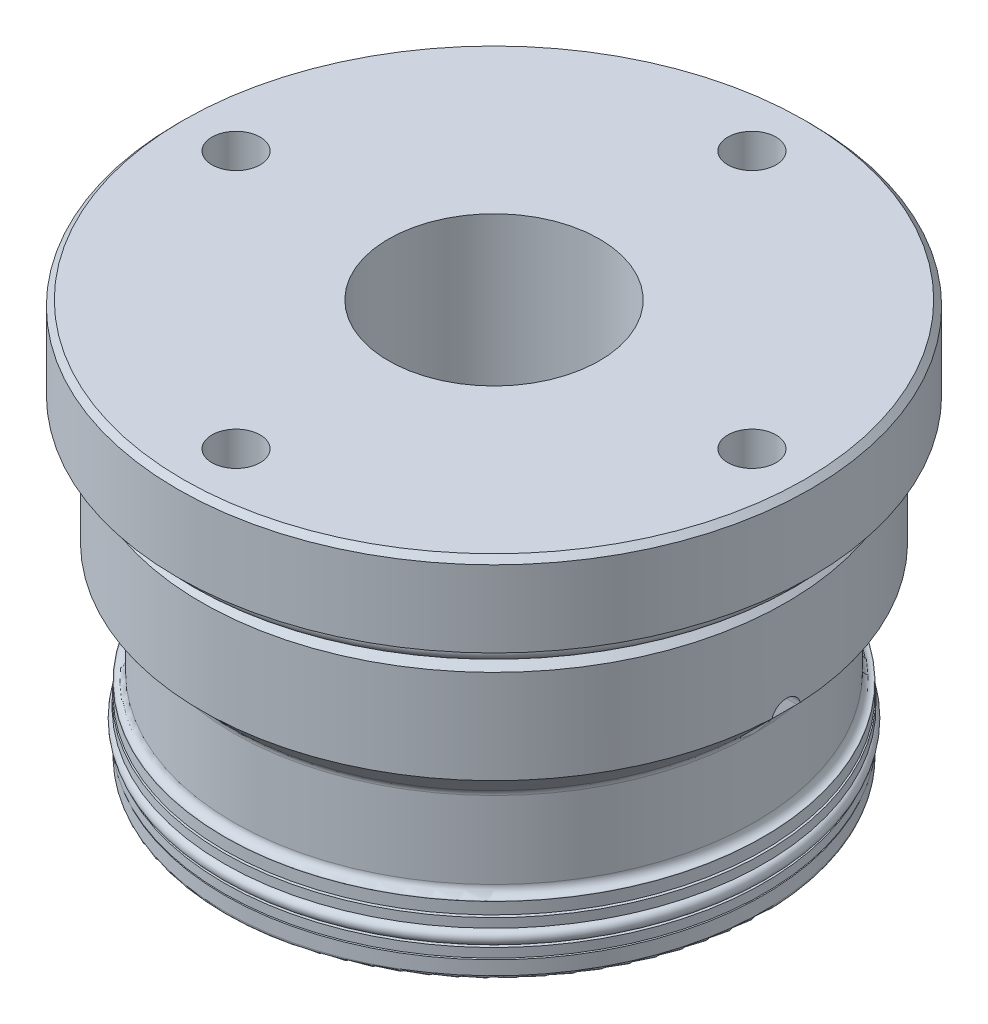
SolidWorks part; units mm, degrees
ref_plane "Front Plane" through (0, 0, 0) normal (0, 0, 1) x (1, 0, 0)
ref_plane "Top Plane" through (0, 0, 0) normal (0, 1, 0) x (1, 0, 0)
ref_plane "Right Plane" through (0, 0, 0) normal (1, 0, 0) x (0, 0, -1)
sketch "Sketch1" plane through (0, 0, 0) normal (0, 0, 1) x (1, 0, 0)
  line L0 (0, 0) -> (0, 29.1031) construction
  line L1 (-30.1625, 0) -> (-30.1625, 27.432)
  line L2 (-30.1625, 27.432) -> (-14.2875, 27.432)
  line L3 (-14.2875, 27.432) -> (-14.2875, 53.975)
  line L4 (-14.2875, 53.975) -> (-42.8625, 53.975)
  line L5 (-42.8625, 53.975) -> (-42.8625, 42.8752)
  line L6 (-42.8625, 42.8752) -> (-39.5986, 42.8752)
  line L7 (-39.5986, 42.8752) -> (-39.5986, 25.5905)
  line L8 (-39.5986, 25.5905) -> (-35.2806, 21.2725)
  line L9 (-35.2806, 21.2725) -> (-35.2806, 9.2202)
  line L10 (-35.2806, 9.2202) -> (-36.4744, 9.2202)
  line L11 (-36.4744, 9.2202) -> (-36.4744, 7.6454)
  line L12 (-36.4744, 7.6454) -> (-35.2171, 7.6454)
  line L13 (-35.2171, 7.6454) -> (-35.2171, 2.3876)
  line L14 (-35.2171, 2.3876) -> (-36.4744, 2.3876)
  line L15 (-36.4744, 2.3876) -> (-36.4744, 0)
  line L16 (-36.4744, 0) -> (-30.1625, 0)
  dimension "D1" = 27.432
  dimension "D2" = 53.975
  dimension "D3" = 85.725
  dimension "D4" = 28.575
  dimension "D5" = 60.325
  dimension "D6" = 72.9488
  dimension "D7" = 2.3876
  dimension "D8" = 1.5748
  dimension "D9" = 70.4342
  dimension "D10" = 5.2578
  dimension "D11" = 42.8752
  dimension "D12" = 79.1972
  dimension "D13" = 70.5612
  dimension "D14" = 25.5905
  dimension "D15" = 45
revolve "Revolve1" add sketch "Sketch1" angle 360 about L0
fillet "Fillet1" radius 1.143 2 edges at (0, 21.2725, -35.2806) (0, 9.2202, -35.2806)
fillet "Fillet2" radius 0.381 2 edges at (0, 7.6454, -35.2171) (0, 2.3876, -35.2171)
fillet "Fillet3" radius 0.508 1 edges at (0, 0, -36.4744)
hole_wizard "Hole1" positions "Sketch3" profile "Sketch2" legacy
sketch "Sketch3" plane through (0, 53.975, 0) normal (0, 1, 0) x (-1, 0, 0)
  circle A0 centre (0, 0) radius 34.925 construction
  point P0 (-34.925, 0)
  dimension "D1" = 34.925
sketch "Sketch2" plane through (34.925, 53.975, 0) normal (1, 0, 0) x (0, 0, 1)
  line L0 (0, 0) -> (0, 8.3111)
  line L1 (0, 8.3111) -> (3.2639, 6.35)
  line L2 (3.2639, 6.35) -> (3.2639, 0)
  line L4 (3.2639, 0) -> (0, 0)
  line L6 (0, 8.3111) -> (-3.2639, 6.35) construction
  line L7 (0, -4.2442) -> (0, 117.3081) construction
  dimension "Diameter" = 6.5278
  dimension "Depth" = 6.35
  dimension "Drill Angle" = 118
pattern_circular "CirPattern1" count 4 over 360 about axis through (0, 0, 0) along (0, 1, 0) of "Hole1"
chamfer "Chamfer1" distance 0.762 angle 45 1 edges at (0, 53.975, -42.8625)
sketch "Sketch4" plane through (0, 0, 0) normal (0, 0, 1) x (1, 0, 0)
  line L0 (0, 0) -> (0, 41.4124) construction
  line L1 (-39.5986, 42.8752) -> (-39.5986, 38.2905)
  line L2 (-39.5986, 42.8752) -> (-39.5986, 25.5905) construction
  line L3 (-39.5986, 38.2905) -> (-38.4683, 39.4208)
  line L4 (-38.4683, 39.4208) -> (-38.4683, 42.8752)
  line L5 (-39.5986, 42.8752) -> (39.5986, 42.8752) construction
  line L6 (-38.4683, 42.8752) -> (-39.5986, 42.8752)
  line L7 (39.5986, 25.5905) -> (-39.5986, 25.5905) construction
  dimension "D1" = 76.9366
  dimension "D2" = 12.7
  dimension "D3" = 45
revolve "Cut-Revolve1" cut sketch "Sketch4" angle 360 about L0
fillet "Fillet4" radius 0.381 2 edges at (0, 39.4208, -38.4683) (0, 42.8752, -38.4683)
sketch "Sketch5" plane through (0, 0, 0) normal (0, 0, 1) x (1, 0, 0)
  line L0 (-42.8625, 42.8752) -> (42.8625, 42.8752) construction
  line L1 (0, 0) -> (0, 42.572) construction
  circle A0 centre (-39.7383, 41.529) radius 1.3081
  dimension "D2" = 2.6162
  dimension "D1" = 1.3462
  dimension "D3" = 79.4766
revolve "Revolve2" add sketch "Sketch5" angle 360 about L1
sketch "Sketch6" plane through (0, 0, 0) normal (0, 0, 1) x (1, 0, 0)
  line L0 (0, 0) -> (0, 49.5791) construction
  line L1 (-35.2171, 7.2644) -> (-35.2171, 2.7686) construction
  line L2 (-35.2171, 6.1468) -> (-36.5633, 6.1468)
  line L3 (-35.2171, 6.1468) -> (-35.2171, 7.3914)
  line L4 (-35.2171, 7.3914) -> (-36.5633, 7.3914)
  line L5 (-36.5633, 6.1468) -> (-36.5633, 7.3914)
  line L6 (-35.2171, 5.0165) -> (-17.8863, 5.0165) construction
  line L7 (-36.5633, 3.8862) -> (-36.5633, 2.6416)
  line L8 (-35.2171, 2.6416) -> (-36.5633, 2.6416)
  line L9 (-35.2171, 3.8862) -> (-35.2171, 2.6416)
  line L10 (-35.2171, 3.8862) -> (-36.5633, 3.8862)
  line L11 (36.4744, 2.3876) -> (-36.4744, 2.3876) construction
  circle A0 centre (-36.0553, 4.9276) radius 0.889
  dimension "D4" = 1.778
  dimension "D5" = 72.1106
  dimension "D6" = 2.54
  dimension "D1" = 1.2446
  dimension "D2" = 73.1266
  dimension "D3" = 2.2606
revolve "Revolve3" add sketch "Sketch6" angle 360 about L0
sketch "Sketch7" plane through (0, 0, 0) normal (1, 0, 0) x (0, 0, -1)
  line L0 (-35.9664, 0) -> (35.9664, 0) construction
  circle A0 centre (0, 25.0698) radius 1.9812
  dimension "D1" = 3.9624
  dimension "D2" = 25.0698
extrude "Cut-Extrude1" cut sketch "Sketch7" against normal through all and the other way through all
sketch "Sketch8" plane through (0, 0, 0) normal (1, 0, 0) x (0, 0, -1)
  line L0 (-1.9812, 25.0698) -> (-1.9812, 20.3073)
  line L1 (0, 25.0698) -> (0, 20.3073) construction
  line L2 (1.9812, 25.0698) -> (1.9812, 20.3073)
  arc A0 (1.9812, 25.0698) -> (-1.9812, 25.0698) centre (0, 25.0698) ccw
  arc A1 (-1.9812, 20.3073) -> (1.9812, 20.3073) centre (0, 20.3073) ccw
  arc A2 (-1.9116, 25.5905) -> (1.9116, 25.5905) centre (0, 25.0698) ccw construction
  dimension "D1" = 4.7625
extrude "Cut-Extrude3" cut sketch "Sketch8" along normal blind 35.2806 from offset 35.2806
mirror "Mirror1" about plane through (0, 0, 0) normal (1, 0, 0) of "Cut-Extrude3"
